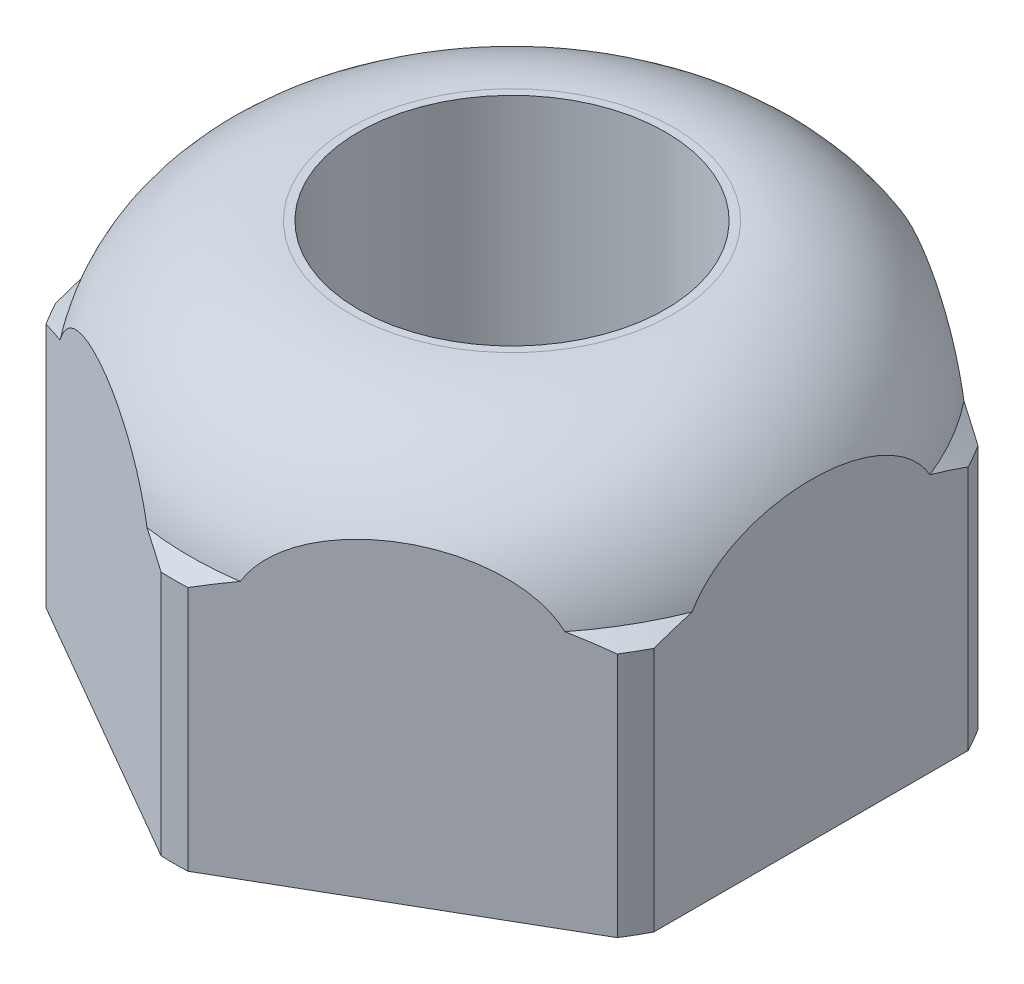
SolidWorks part; units mm, degrees
ref_plane "Front" through (0, 0, 0) normal (0, 0, 1) x (1, 0, 0)
ref_plane "Top" through (0, 0, 0) normal (0, 1, 0) x (1, 0, 0)
ref_plane "Right" through (0, 0, 0) normal (1, 0, 0) x (0, 0, -1)
sketch "Sketch1" plane through (0, 0, 0) normal (0, 0, 1) x (1, 0, 0)
  line L0 (0, -25.4) -> (0, 25.4) construction
  line L1 (2.413, 0) -> (2.413, 6.096)
  line L2 (5.3086, 3.8608) -> (5.0565, 4.0541)
  line L3 (2.413, 6.096) -> (2.54, 6.096)
  line L4 (-5.3086, 3.8608) -> (-5.3086, 0) construction
  line L7 (5.3086, 0) -> (2.413, 0)
  line L10 (5.3086, 3.8608) -> (5.3086, 0)
  arc A0 (2.54, 6.096) -> (5.0565, 4.0541) centre (2.54, 3.5243) cw
  dimension "D1" = 6.096
  dimension "D2" = 10.6172
  dimension "D3" = 3.8608
  dimension "D4" = 2.413
  dimension "D5" = 127.486
  dimension "D6" = 0.127
revolve "Base-Revolve" add sketch "Sketch1" angle 360 about L0
sketch "Sketch2" plane through (0, 0, 0) normal (0, 1, 0) x (1, 0, 0)
  line L0 (4.699, 2.713) -> (0, 5.4259)
  line L1 (0, 5.4259) -> (-4.699, 2.713)
  line L2 (-4.699, 2.713) -> (-4.699, -2.713)
  line L3 (-4.699, -2.713) -> (0, -5.4259)
  line L4 (0, -5.4259) -> (4.699, -2.713)
  line L5 (4.699, -2.713) -> (4.699, 2.713)
  line L6 (20.7527, 19.5533) -> (-19.7306, 19.5533)
  line L7 (-19.7306, 19.5533) -> (-19.7306, -19.5374)
  line L8 (-19.7306, -19.5374) -> (20.7527, -19.5374)
  line L9 (20.7527, -19.5374) -> (20.7527, 19.5533)
  line L10 (0, 0) -> (4.699, 2.713) construction
  line L11 (0, 0) -> (4.699, -2.713) construction
  line L12 (0, 0) -> (0, 5.4259) construction
  dimension "D1" = 9.398
  dimension "D2" = 60
  dimension "D3" = 60
extrude "Cut-Extrude1" cut sketch "Sketch2" along normal blind 31.6992
